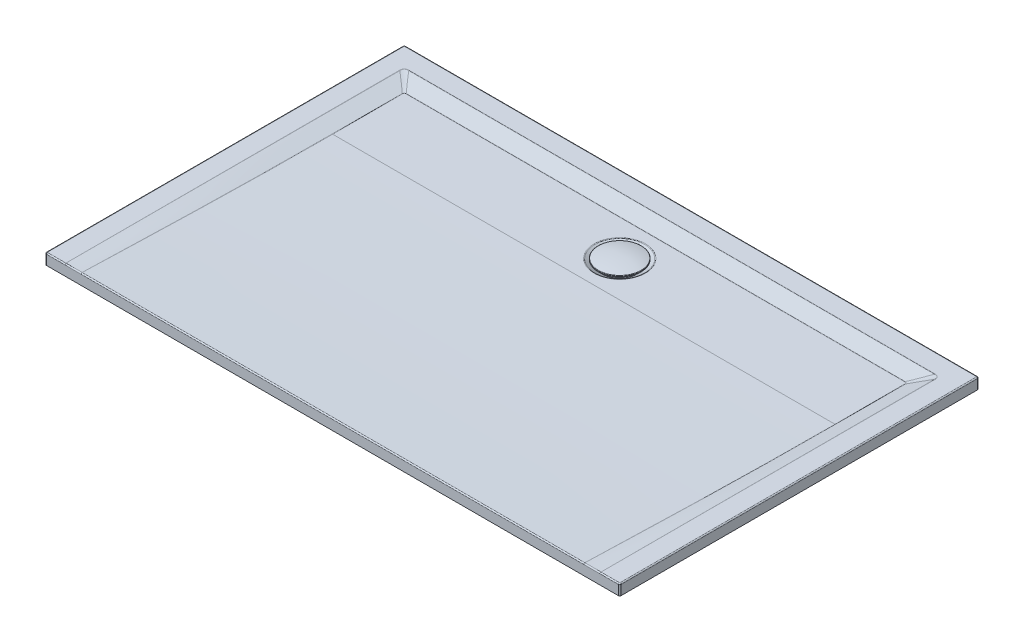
SolidWorks part; units mm, degrees
ref_plane "Płaszczyzna przednia" through (0, 0, 0) normal (0, 0, 1) x (1, 0, 0)
ref_plane "Płaszczyzna górna" through (0, 0, 0) normal (0, 1, 0) x (1, 0, 0)
ref_plane "Płaszczyzna prawa" through (0, 0, 0) normal (1, 0, 0) x (0, 0, -1)
sketch "Szkic1" plane through (0, 0, 0) normal (0, 1, 0) x (1, 0, 0)
  line L0 (0, 500) -> (0, -500) construction
  line L1 (-800, 500) -> (800, 500)
  line L2 (-800, 500) -> (-800, -500)
  line L3 (-800, -500) -> (800, -500)
  line L4 (800, 500) -> (800, -500)
  line L5 (-745, -500) -> (-745, 445)
  line L6 (-745, 445) -> (745, 445)
  line L7 (745, 445) -> (745, -500)
  line L8 (-700, -500) -> (-700, 400)
  line L9 (-700, 400) -> (700, 400)
  line L10 (700, 400) -> (700, -500)
  circle A0 centre (0, 300) radius 45
  circle A1 centre (0, 300) radius 70
  point P9 (0, 445)
  dimension "D6" = 90
  dimension "D7" = 140
  dimension "D1" = 1600
  dimension "D2" = 55
  dimension "D3" = 55
  dimension "D5" = 200
  dimension "D8" = 1000
  dimension "D4" = 45
sketch "Szkic2" plane through (0, 0, 0) normal (0, 1, 0) x (1, 0, 0)
  line L0 (-800, -500) -> (800, -500) construction
  line L1 (800, 500) -> (800, -500) construction
  line L2 (745, 445) -> (745, -500) construction
  line L3 (-745, 445) -> (745, 445) construction
  line L4 (-800, 500) -> (800, 500) construction
  line L5 (-745, -500) -> (-745, 445) construction
  line L6 (-800, 500) -> (-800, -500) construction
  line L7 (-800, -500) -> (-745, -500)
  line L8 (800, 500) -> (800, -500)
  line L9 (745, 445) -> (745, -500)
  line L10 (-745, 445) -> (745, 445)
  line L11 (-800, 500) -> (800, 500)
  line L12 (-745, -500) -> (-745, 445)
  line L13 (-800, 500) -> (-800, -500)
  line L14 (745, -500) -> (800, -500)
surface "Powierzchnia-Płaszczyzna1" sketch "Szkic2"
ref_plane "Płaszczyzna1" through (0, -15, 0) normal (0, 1, 0) x (-1, 0, 0)
sketch "Szkic3" plane through (0, -15, 0) normal (0, 1, 0) x (-1, 0, 0)
  line L0 (700, -200) -> (-700, -200)
  line L1 (700, 500) -> (700, -400) construction
  line L2 (-700, -400) -> (-700, 500) construction
  line L3 (0, -200) -> (0, -400) construction
  line L4 (700, -400) -> (-700, -400) construction
  line L5 (-700, -400) -> (-700, -200)
  line L6 (700, -200) -> (700, -400)
  line L7 (700, -400) -> (-700, -400)
  circle A0 centre (0, -300) radius 70 construction
  circle A1 centre (0, -300) radius 70
  point P10 (0, -300)
surface "Powierzchnia-Płaszczyzna2" sketch "Szkic3"
sketch "Szkic4" plane through (0, 0, 0) normal (0, 1, 0) x (1, 0, 0)
  line L0 (700, -500) -> (-700, -500)
other "Granica-Powierzchnia1"
other "Granica-Powierzchnia2"
other "Granica-Powierzchnia3"
mirror "Lustro1" about plane through (0, 0, 0) normal (1, 0, 0)
sketch "Szkic5" plane through (0, 0, 0) normal (0, 1, 0) x (1, 0, 0)
  line L0 (800, 500) -> (800, -500) construction
  line L1 (-800, 500) -> (800, 500) construction
  line L2 (-800, 500) -> (-800, -500) construction
  line L3 (-800, -500) -> (800, -500) construction
  line L4 (800, 500) -> (800, -500)
  line L5 (-800, 500) -> (800, 500)
  line L6 (-800, 500) -> (-800, -500)
  line L7 (-800, -500) -> (800, -500)
surface "Powierzchnia-Wyciągnięcie1" sketch "Szkic5" parameters "D1"=30
sketch "Szkic7" plane through (0, 0, 0) normal (1, 0, 0) x (0, 0, -1)
  line L0 (300, 0) -> (300, -30) construction
  line L1 (500, -30) -> (-500, -30) construction
  line L2 (345, -30) -> (345, -28)
  line L3 (345, -28) -> (349, -28)
  line L6 (349, -28) -> (370, -15)
  dimension "D1" = 90
  dimension "D2" = 2
  dimension "D3" = 98
surface "Powierzchnia-Obrót wokół linii środkowej1" sketch "Szkic7" parameters "D1"=360
surface "Powierzchnia-Płaszczyzna3"
surface "Powierzchnia-Połącz1"
fillet "Zaokrąglenie1" radius 4 6 edges at (0, -28, -349) (0, -15, -230) (800, -15, 500) (800, -15, -500) (-800, -15, -500) (-800, -15, 500)
fillet "Zmienne zaokrąglenie1" radius 40 2 edges at (722.5, -7.5, -422.5)
fillet "Zaokrąglenie3" radius 3 12 edges
fillet "Zaokrąglenie4" radius 3 12 edges at (-798.8284, 0, -498.8284) (0, 0, -500) (798.8284, 0, -498.8284) (800, 0, 0) (798.8284, 0, 498.8284) (770.5, 0, 500) (-770.5, 0, 500) (-798.8284, 0, 498.8284) (-800, 0, 0)
sketch "Szkic8" plane through (0, 0, 0) normal (1, 0, 0) x (0, 0, -1)
  line L0 (300, 0) -> (300, -30) construction
  line L1 (300, -5.6601) -> (179.8469, -5.6601) construction
  line L2 (360, -14.7573) -> (360, -17)
  line L3 (360, -17) -> (300, -17)
  line L4 (300, -17) -> (300, -5.6601)
  line L5 (300, -5.6601) -> (199.9922, 95.6514)
  arc A0 (300, -5.6601) -> (359.2694, -13.7943) centre (300, -225.6601) cw
  arc A1 (359.2694, -13.7943) -> (360, -14.7573) centre (359, -14.7573) cw
  point P11 (360, -14)
  dimension "D1" = 220
  dimension "D4" = 1
  dimension "D2" = 60
  dimension "D3" = 3
  dimension "D5" = 13
revolve "Obrót wokół linii środkowej1" add sketch "Szkic8" angle 360 about L4
